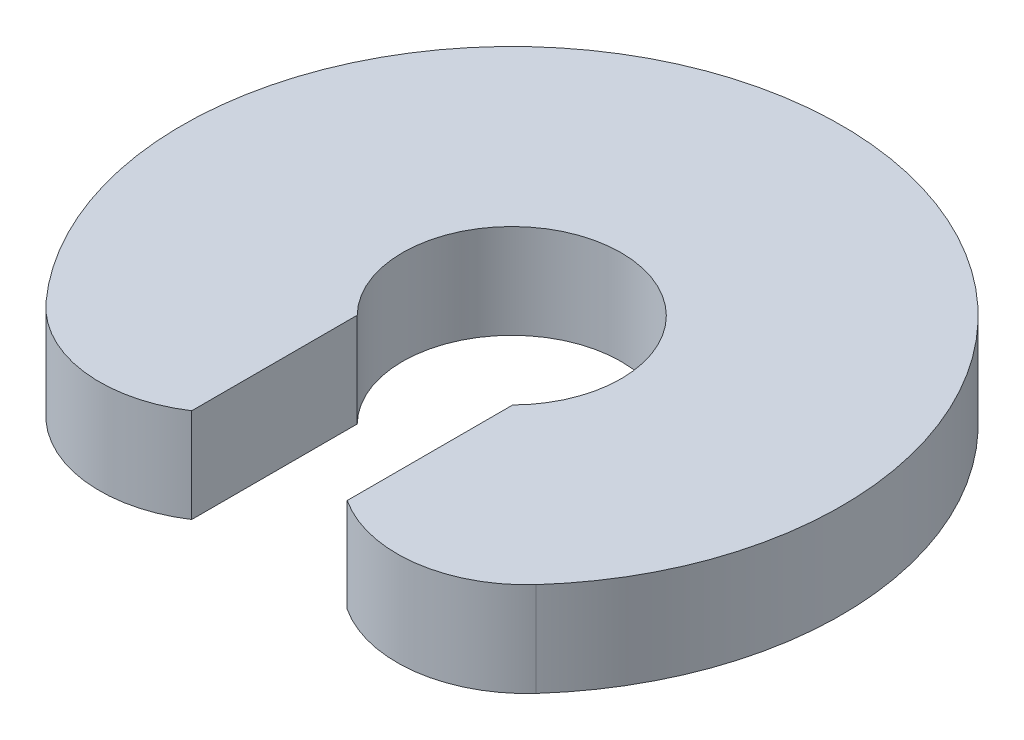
SolidWorks part; units mm, degrees
ref_plane "前视基准面" through (0, 0, 0) normal (0, 0, 1) x (1, 0, 0)
ref_plane "上视基准面" through (0, 0, 0) normal (0, 1, 0) x (1, 0, 0)
ref_plane "右视基准面" through (0, 0, 0) normal (1, 0, 0) x (0, 0, -1)
sketch "草图1" plane through (0, 0, 0) normal (0, 1, 0) x (1, 0, 0)
  line L0 (0, 0) -> (0, 425) construction
  line L1 (0, 425) -> (0, 700) construction
  line L2 (0, 0) -> (315.8366, -284.3805) construction
  line L3 (0, 0) -> (-315.8366, -284.3805) construction
  line L4 (0, 425) -> (137.5, 186.843) construction
  line L5 (165, -163.0692) -> (165, -277.5557)
  line L6 (-165, -163.0692) -> (-165, -277.5557)
  line L7 (-165, -277.5557) -> (-165, -514.3225) construction
  line L8 (165, -514.3225) -> (165, -277.5557) construction
  arc A1 (520.2014, -468.3914) -> (-520.2014, -468.3914) centre (0, 0) ccw
  arc A2 (165, -514.3225) -> (520.2014, -468.3914) centre (315.8366, -284.3805) ccw
  arc A3 (165, -163.0692) -> (-165, -163.0692) centre (0, 0) ccw
  arc A5 (-165, -514.3225) -> (-43.1531, -320) centre (-315.8366, -284.3805) ccw
  arc A6 (-520.2014, -468.3914) -> (-165, -514.3225) centre (-315.8366, -284.3805) ccw
  arc A7 (165, -514.3225) -> (43.1531, -320) centre (315.8366, -284.3805) cw
  arc A8 (-43.1531, -320) -> (-165, -277.5557) centre (0, 0) cw
  arc A9 (43.1531, -320) -> (165, -277.5557) centre (0, 0) ccw
  dimension "D1" = 425
  dimension "D3" = 132
  dimension "D7" = 425
  dimension "D8" = 330
  dimension "D9" = 320
  dimension "D2" = 275
  dimension "D4" = 132
  dimension "D5" = 275
  dimension "D6" = 30
extrude "凸台-拉伸1" add sketch "草图1" along normal blind 200 contours A1 A6 L6 A3 L5 A2
sketch "草图3" plane through (0, 200, 0) normal (0, 1, 0) x (1, 0, 0)
  line L1 (-447.91, 231.984) -> (447.91, 231.984)
  line L2 (-447.91, 231.984) -> (-447.91, 537.9374)
  line L3 (-447.91, 537.9374) -> (447.91, 537.9374)
  line L4 (447.91, 231.984) -> (447.91, 537.9374)
  line L5 (-447.91, 231.984) -> (447.91, 537.9374) construction
  line L6 (-447.91, 537.9374) -> (447.91, 231.984) construction
  arc A0 (520.2014, -468.3914) -> (-520.2014, -468.3914) centre (0, 0) ccw construction
  arc A1 (165, -163.0692) -> (-165, -163.0692) centre (0, 0) ccw construction
  arc A2 (165, -163.0692) -> (-165, -163.0692) centre (0, 0) ccw construction
  point P0 (0, 384.9607)
  dimension "D1" = 447.91
extrude "切除-拉伸2" [suppressed] cut sketch "草图3" against normal through all
sketch3d "3D草图2" [suppressed]
  line L0 (-447.91, 200, -537.9374) -> (447.91, 0, -165)
  line L1 (-447.91, 200, -165) -> (447.91, 0, -537.9374)
  point P8 (0, 100, -351.4687)
  point P9 (-358.323, 179.9989, -500.6416)
  point P10 (-358.323, 179.9989, -202.2958)
  point P11 (358.323, 20.0011, -500.6416)
  point P12 (358.3276, 20.0001, -202.2939)
  dimension "D1" = 99.08
  dimension "D2" = 99.08
  dimension "D3" = 99.075
  dimension "D4" = 99.08
sketch "草图4" plane through (0, 0, 0) normal (0, -1, 0) x (1, 0, 0)
  line L1 (165, 514.3225) -> (-165, 514.3225)
  line L2 (165, 514.3225) -> (165, 277.5557)
  line L3 (165, 277.5557) -> (-165, 277.5557)
  line L4 (-165, 514.3225) -> (-165, 277.5557)
  line L5 (165, 514.3225) -> (-165, 277.5557) construction
  line L6 (165, 277.5557) -> (-165, 514.3225) construction
  arc A0 (-43.1531, 320) -> (-520.2014, 468.3914) centre (-315.8366, 284.3805) ccw construction
  point P0 (0, 395.9391)
extrude "切除-拉伸3" cut sketch "草图4" against normal through all
